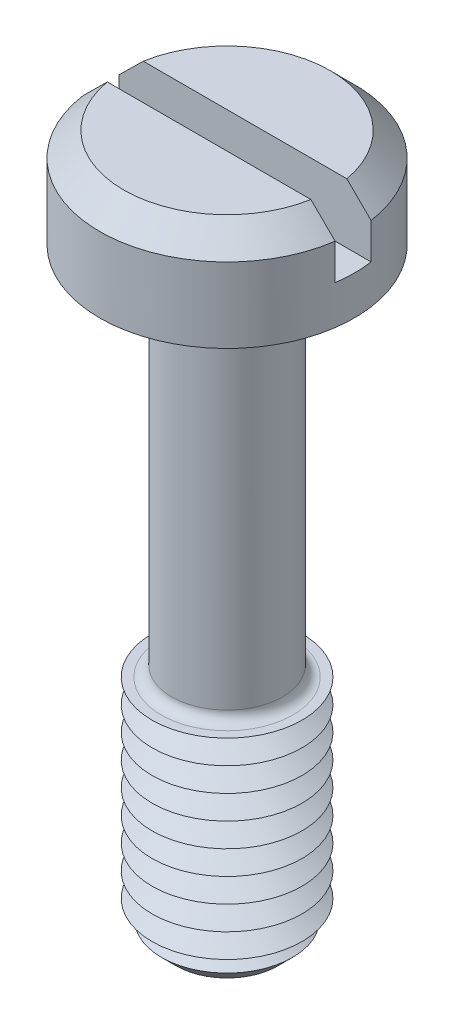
SolidWorks part; units mm, degrees
ref_plane "Front Plane" through (0, 0, 0) normal (0, 0, 1) x (1, 0, 0)
ref_plane "Top Plane" through (0, 0, 0) normal (0, 1, 0) x (1, 0, 0)
ref_plane "Right Plane" through (0, 0, 0) normal (1, 0, 0) x (0, 0, -1)
sketch "Sketch1" plane through (0, 0, 0) normal (0, 1, 0) x (1, 0, 0)
  circle A0 centre (0, 0) radius 4.25
  dimension "D1" = 8.5
extrude "Boss-Extrude1" add sketch "Sketch1" along normal blind 3.3
sketch "Sketch2" plane through (0, 0, 0) normal (0, -1, 0) x (1, 0, 0)
  circle A0 centre (0, 0) radius 1.85
  dimension "D1" = 3.7
extrude "Boss-Extrude2" add sketch "Sketch2" along normal blind 20
sketch "Sketch3" plane through (0, -20, 0) normal (0, -1, 0) x (1, 0, 0)
  circle A0 centre (0, 0) radius 2.5
  dimension "D1" = 5
extrude "Boss-Extrude3" add sketch "Sketch3" against normal blind 7.5
chamfer "Chamfer1" distance 0.8 angle 45 1 edges at (0, -20, -2.5)
sketch "Sketch4" plane through (0, 0, 0) normal (1, 0, 0) x (0, 0, -1)
  line L0 (0, -6.5871) -> (0, -12.0372) construction
sketch "Sketch5" plane through (0, 0, 0) normal (1, 0, 0) x (0, 0, -1)
  line L0 (-2.5, -12.5) -> (-1.8072, -12.9)
  line L1 (-1.8072, -12.9) -> (-2.5, -13.3)
  line L2 (-2.5, -12.5) -> (-2.5, -19.2) construction
  line L3 (-2.5, -13.3) -> (-2.5, -12.5)
  dimension "D1" = 0.8
revolve "Cut-Revolve1" cut sketch "Sketch5" angle 360 about L0
pattern_linear "LPattern1" count 9 spacing 0.8 along (0, -1, 0) of "Cut-Revolve1"
fillet "Fillet1" radius 0.35 2 edges at (0, -12.5, -1.85) (0, 0, -1.85)
chamfer "Chamfer2" distance 0.8 angle 45 1 edges at (0, 3.3, 4.25)
sketch "Sketch6" plane through (0, 3.3, 0) normal (0, 1, 0) x (1, 0, 0)
  line L1 (4.25, -0.6) -> (-4.25, -0.6)
  line L2 (4.25, -0.6) -> (4.25, 0.6)
  line L3 (4.25, 0.6) -> (-4.25, 0.6)
  line L4 (-4.25, -0.6) -> (-4.25, 0.6)
  line L5 (4.25, -0.6) -> (-4.25, 0.6) construction
  line L6 (4.25, 0.6) -> (-4.25, -0.6) construction
  circle A0 centre (0, 0) radius 4.25 construction
  point P0 (0, 0)
  dimension "D1" = 1.2
extrude "Cut-Extrude1" cut sketch "Sketch6" against normal blind 2
